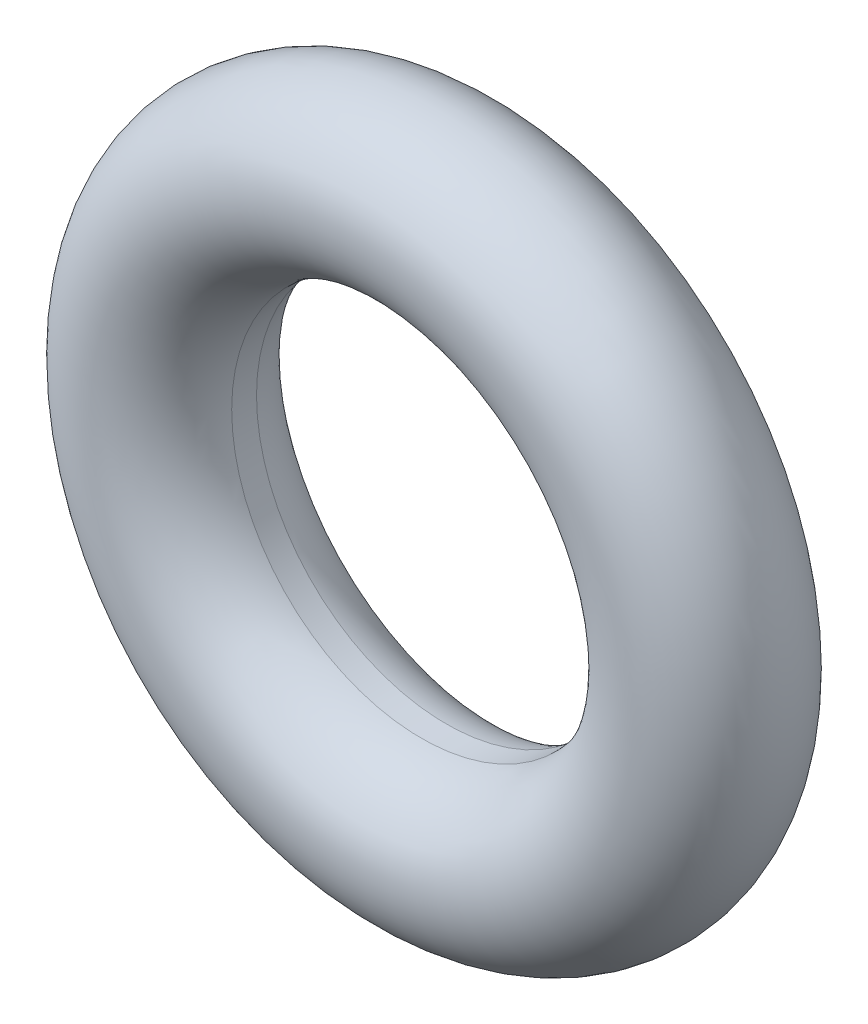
SolidWorks part; units mm, degrees
ref_plane "Front" through (0, 0, 0) normal (0, 0, 1) x (1, 0, 0)
ref_plane "Top" through (0, 0, 0) normal (0, 1, 0) x (1, 0, 0)
ref_plane "Right" through (0, 0, 0) normal (1, 0, 0) x (0, 0, -1)
sketch "Sketch1" plane through (0, 0, 0) normal (0, 0, 1) x (1, 0, 0)
  circle A0 centre (0, 0) radius 4.32
  dimension "D1" = 8.64
sketch "Sketch2" plane through (0, 0, 0) normal (1, 0, 0) x (0, 0, -1)
  line L0 (0, 4.32) -> (0, -4.32) construction
  circle A0 centre (0, 4.32) radius 1.31
  dimension "D1" = 2.62
  dimension "D2" = 4.32
sweep "Base-Sweep" add profiles "Sketch2" path "Sketch1"
sketch "Sketch3" plane through (0, 0, 0) normal (0, 0, 1) x (1, 0, 0)
  circle A0 centre (0, 0) radius 3.025
  dimension "D1" = 6.05
extrude "Cut-Extrude1" cut sketch "Sketch3" against normal through all and the other way through all
